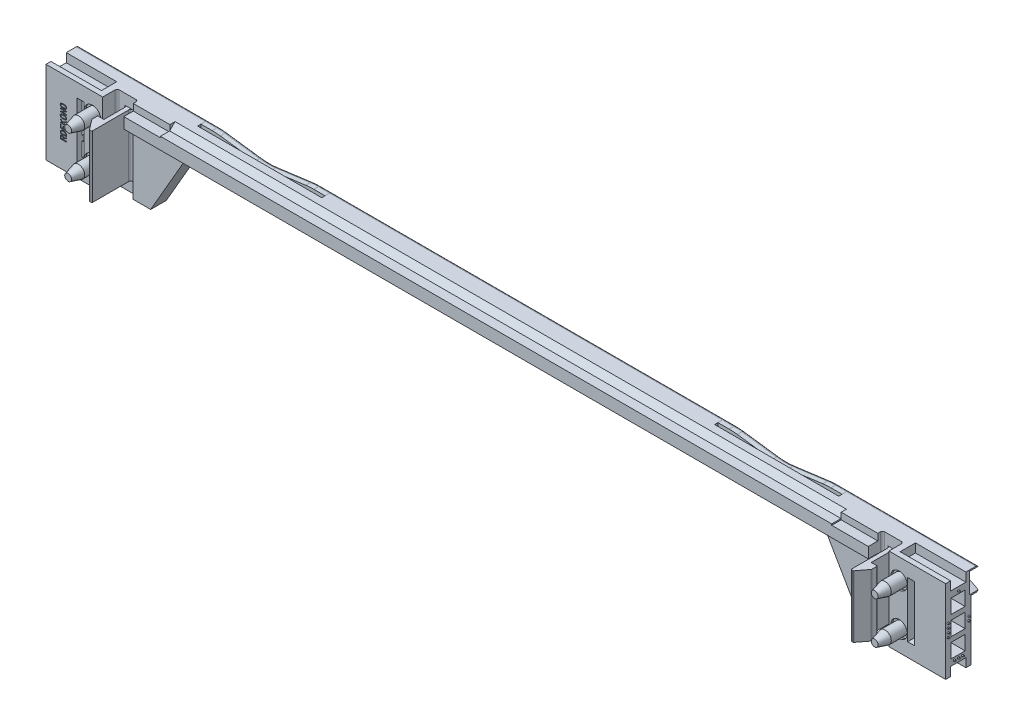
SolidWorks part; units mm, degrees
ref_plane "前视基准面" through (0, 0, 0) normal (0, 0, 1) x (1, 0, 0)
ref_plane "上视基准面" through (0, 0, 0) normal (0, 1, 0) x (1, 0, 0)
ref_plane "右视基准面" through (0, 0, 0) normal (1, 0, 0) x (0, 0, -1)
sketch "草图1" plane through (0, 0, 0) normal (0, 0, 1) x (1, 0, 0)
  line L0 (-77.35, 4.525) -> (77.35, 4.525)
  line L1 (-108.75, 10.025) -> (108.75, 10.025)
  line L2 (-108.75, 10.025) -> (-108.75, -10.025)
  line L3 (-108.75, -10.025) -> (-85.75, -10.025)
  line L4 (108.75, 10.025) -> (108.75, -10.025)
  line L5 (-108.75, 10.025) -> (108.75, -10.025) construction
  line L6 (-108.75, -10.025) -> (108.75, 10.025) construction
  line L7 (-77.35, 4.525) -> (-85.75, -10.025)
  line L8 (77.35, 4.525) -> (85.75, -10.025)
  line L9 (85.75, -10.025) -> (108.75, -10.025)
  point P0 (0, 0)
  point P8 (0, 4.525)
  dimension "D1" = 217.5
  dimension "D2" = 20.05
  dimension "D3" = 5.5
  dimension "D4" = 23
  dimension "D5" = 31.4
extrude "凸台-拉伸1" add sketch "草图1" along normal mid plane 6.1
sketch "草图2" plane through (0, -10.025, 0) normal (0, -1, 0) x (1, 0, 0)
  line L0 (-77.35, 3.05) -> (77.35, 3.05) construction
  line L1 (-95.05, 3.05) -> (95.05, 3.05)
  line L2 (-108.75, -3.05) -> (-85.75, -3.05) construction
  line L3 (-90, 0.75) -> (90, 0.75)
  line L5 (90, 0.75) -> (90, 0.05)
  line L6 (90.5, -0.45) -> (94.55, -0.45)
  line L7 (95.05, 0.05) -> (95.05, 3.05)
  line L8 (85.75, 3.05) -> (108.75, 3.05) construction
  line L9 (-90, 0.75) -> (-90, 0.05)
  line L10 (-90.5, -0.45) -> (-94.55, -0.45)
  line L11 (-95.05, 0.05) -> (-95.05, 3.05)
  line L12 (-108.75, 3.05) -> (-85.75, 3.05) construction
  line L13 (108.75, 3.05) -> (108.75, -3.05) construction
  line L15 (-77.35, -3.05) -> (77.35, -3.05) construction
  arc A0 (-90, 0.05) -> (-90.5, -0.45) centre (-90.5, 0.05) cw
  arc A1 (-94.55, -0.45) -> (-95.05, 0.05) centre (-94.55, 0.05) cw
  arc A2 (94.55, -0.45) -> (95.05, 0.05) centre (94.55, 0.05) ccw
  arc A3 (90, 0.05) -> (90.5, -0.45) centre (90.5, 0.05) ccw
  point P6 (0, 0.75)
  point P22 (-90, -0.45)
  point P25 (-95.05, -0.45)
  dimension "D7" = 0.5
  dimension "D8" = 0.5
  dimension "D1" = 3.8
  dimension "D2" = 13.7
  dimension "D3" = 180
  dimension "D6" = 2.6
extrude "切除-拉伸1" cut sketch "草图2" against normal through all
ref_plane "基准面1" through (0, -7.525, 0) normal (0, -1, 0) x (-1, 0, 0)
sketch "草图3" plane through (0, -7.525, 0) normal (0, -1, 0) x (-1, 0, 0)
  line L0 (91.75, 0.45) -> (92.75, 0.45)
  line L1 (94.55, 0.45) -> (90.5, 0.45) construction
  line L2 (92.75, 0.45) -> (92.75, -5.05)
  line L3 (92.75, -5.05) -> (94.25, -5.05)
  line L4 (94.25, -5.05) -> (94.25, -6.45)
  line L5 (94.25, -6.45) -> (92.35, -8.95)
  line L6 (92.35, -8.95) -> (91.75, -8.95)
  line L7 (91.75, -8.95) -> (91.75, 0.45)
  line L8 (95.05, -3.05) -> (108.75, -3.05) construction
  line L9 (108.75, 3.05) -> (85.75, 3.05) construction
  line L10 (0, 0) -> (0, -11.725) construction
  line L11 (-91.75, -8.95) -> (-91.75, 0.45)
  line L12 (-92.35, -8.95) -> (-91.75, -8.95)
  line L13 (-94.25, -6.45) -> (-92.35, -8.95)
  line L14 (-94.25, -5.05) -> (-94.25, -6.45)
  line L15 (-92.75, -5.05) -> (-94.25, -5.05)
  line L16 (-92.75, 0.45) -> (-92.75, -5.05)
  line L17 (-91.75, 0.45) -> (-92.75, 0.45)
  line L18 (108.75, -3.05) -> (108.75, 3.05) construction
  dimension "D1" = 1
  dimension "D2" = 14.5
  dimension "D3" = 12
  dimension "D4" = 2
  dimension "D5" = 2.5
  dimension "D6" = 9.5
  dimension "D7" = 0.6
extrude "凸台-拉伸2" add sketch "草图3" against normal blind 15
sketch "草图4" plane through (0, 0, 0.75) normal (0, 0, 1) x (1, 0, 0)
  line L0 (-90, 10.025) -> (90, 10.025) construction
  line L1 (-90, 8.725) -> (90, 8.725)
  line L2 (-90, 8.725) -> (-90, 5.825)
  line L3 (-90, 5.825) -> (90, 5.825)
  line L4 (90, 8.725) -> (90, 5.825)
  line L5 (-90, 8.725) -> (90, 5.825) construction
  line L6 (-90, 5.825) -> (90, 8.725) construction
  line L8 (-90, 10.025) -> (-90, -10.025) construction
  point P0 (0, 7.275)
  dimension "D1" = 2.9
  dimension "D2" = 1.3
extrude "凸台-拉伸3" add sketch "草图4" along normal blind 2.25
chamfer "倒角6" distance 1.3 angle 45 1 edges at (0, 4.525, 0.75)
sketch "草图17" plane through (0, 0, 3) normal (0, 0, 1) x (1, 0, 0)
  line L0 (90, 10.025) -> (90, -10.025) construction
  line L1 (90, 8.425) -> (81.15, 8.425)
  line L2 (90, 8.425) -> (90, 10.025)
  line L3 (90, 10.025) -> (81.15, 10.025)
  line L4 (81.15, 8.425) -> (81.15, 10.025)
  line L5 (-90, 10.025) -> (90, 10.025) construction
  line L6 (0, 8.725) -> (0, 15.7989) construction
  line L7 (90, 8.725) -> (-90, 8.725) construction
  line L8 (-81.15, 8.425) -> (-81.15, 10.025)
  line L9 (-90, 10.025) -> (-81.15, 10.025)
  line L10 (-90, 8.425) -> (-90, 10.025)
  line L11 (-90, 8.425) -> (-81.15, 8.425)
  dimension "D1" = 162.3
  dimension "D2" = 1.6
extrude "切除-拉伸10" cut sketch "草图17" against normal blind 2.3
sketch "草图18" plane through (81.15, 0, 0) normal (1, 0, 0) x (0, 0, -1)
  line L0 (-0.75, 10.025) -> (-0.75, 8.725)
  line L1 (-0.75, 8.725) -> (0.55, 10.025)
  line L2 (0.55, 10.025) -> (-0.75, 10.025)
extrude "切除-拉伸11" cut sketch "草图18" against normal up to surface (162.3 mm away)
sketch "草图10" plane through (0, 0, 3.05) normal (0, 0, 1) x (1, 0, 0)
  line L1 (108.75, -10.025) -> (108.75, 10.025) construction
  line L2 (0, 0) -> (0, -13.4841) construction
  circle A0 centre (97.5, 5.08) radius 1.5
  circle A1 centre (97.5, -5.08) radius 1.5
  circle A2 centre (-97.5, -5.08) radius 1.5
  circle A3 centre (-97.5, 5.08) radius 1.5
  point P4 (108.75, 0)
  dimension "D1" = 10.16
  dimension "D2" = 5.08
  dimension "D3" = 3
  dimension "D4" = 195
extrude "凸台-拉伸4" add sketch "草图10" along normal blind 5.9
sketch "草图19" plane through (0, 0, 3.05) normal (0, 0, 1) x (1, 0, 0)
  circle A0 centre (97.5, 5.08) radius 2
  circle A1 centre (97.5, -5.08) radius 2
  circle A2 centre (-97.5, 5.08) radius 2
  circle A3 centre (-97.5, -5.08) radius 2
  circle A4 centre (-97.5, -5.08) radius 1.5
  circle A5 centre (-97.5, 5.08) radius 1.5
  circle A6 centre (97.5, 5.08) radius 1.5
  circle A7 centre (97.5, -5.08) radius 1.5
  dimension "D1" = 3
  dimension "D2" = 4
extrude "切除-拉伸12" cut sketch "草图19" against normal blind 0.5
chamfer "倒角7" distance 2.5 angle 15 4 edges at (-99, 5.08, 8.95) (99, 5.08, 8.95) (99, -5.08, 8.95) (-99, -5.08, 8.95)
sketch "草图12" plane through (-108.75, 0, 0) normal (-1, 0, 0) x (0, 0, 1)
  line L0 (3.05, 10.025) -> (-3.05, 10.025) construction
  line L1 (-1.85, 10.025) -> (1.85, 10.025)
  line L2 (-1.85, 10.025) -> (-1.85, 7.9)
  line L3 (-1.85, 7.9) -> (1.85, 7.9)
  line L4 (1.85, 10.025) -> (1.85, 7.9)
  line L5 (3.05, -10.025) -> (-3.05, -10.025) construction
  line L6 (-1.85, -10.025) -> (1.85, -10.025)
  line L7 (-1.85, -10.025) -> (-1.85, -7.9)
  line L8 (-1.85, -7.9) -> (1.85, -7.9)
  line L9 (1.85, -10.025) -> (1.85, -7.9)
  line L10 (-3.05, 10.025) -> (-3.05, -10.025) construction
  line L11 (3.05, 10.025) -> (3.05, -10.025) construction
  dimension "D1" = 15.8
  dimension "D2" = 1.2
  dimension "D5" = 1.2
extrude "切除-拉伸7" cut sketch "草图12" against normal blind 12.2
sketch "草图13" plane through (-108.75, 0, 0) normal (-1, 0, 0) x (0, 0, 1)
  line L0 (-1.85, 10.025) -> (-1.85, 7.9) construction
  line L1 (-1.85, 6.375) -> (1.6, 6.375)
  line L2 (-1.85, 6.375) -> (-1.85, 2.925)
  line L3 (-1.85, 2.925) -> (1.6, 2.925)
  line L4 (1.6, 6.375) -> (1.6, 2.925)
  line L5 (-1.85, 6.375) -> (1.6, 2.925) construction
  line L6 (-1.85, 2.925) -> (1.6, 6.375) construction
  line L8 (-1.85, 1.725) -> (-1.85, -1.725)
  line L9 (-1.85, 1.725) -> (1.6, 1.725)
  line L10 (-1.85, -1.725) -> (1.6, -1.725)
  line L11 (1.6, 1.725) -> (1.6, -1.725)
  line L12 (-1.85, -2.925) -> (-1.85, -6.375)
  line L13 (-1.85, -2.925) -> (1.6, -2.925)
  line L14 (-1.85, -6.375) -> (1.6, -6.375)
  line L15 (1.6, -2.925) -> (1.6, -6.375)
  point P0 (-0.125, 4.65)
  point P7 (1.6, 0)
  dimension "D1" = 3.45
  dimension "D2" = 3.45
  dimension "D4" = 4.65
  dimension "D3" = 3
extrude "切除-拉伸8" cut sketch "草图13" against normal blind 7.8
sketch "草图30" plane through (0, 0, -3.05) normal (0, 0, -1) x (-1, 0, 0)
  line L0 (-108.75, -10.025) -> (-108.75, 10.025) construction
  line L1 (108.75, 10.025) -> (-108.75, 10.025)
  line L2 (108.75, 10.025) -> (108.75, 4.525)
  line L3 (108.75, 4.525) -> (-108.75, 4.525)
  line L4 (-108.75, 10.025) -> (-108.75, 4.525)
  line L5 (77.35, 4.525) -> (-77.35, 4.525) construction
extrude "切除-拉伸16" cut sketch "草图30" against normal blind 0.3
sketch "草图14" plane through (0, 0, -2.75) normal (0, 0, -1) x (-1, 0, 0)
  line L0 (108.75, 4.525) -> (108.75, -10.025) construction
  line L1 (-108.75, 10.025) -> (108.75, 10.025)
  line L2 (-108.75, 10.025) -> (-108.75, 8.725)
  line L3 (-108.75, 8.725) -> (108.75, 8.725)
  line L4 (108.75, 10.025) -> (108.75, 8.725)
  line L5 (-108.75, -10.025) -> (-108.75, 4.525) construction
  line L6 (-108.75, 5.825) -> (108.75, 5.825)
  line L7 (-108.75, 5.825) -> (-108.75, 4.525)
  line L8 (-108.75, 4.525) -> (108.75, 4.525)
  line L9 (108.75, 5.825) -> (108.75, 4.525)
  line L10 (77.35, 4.525) -> (-77.35, 4.525) construction
  line L11 (108.75, 10.025) -> (-108.75, 10.025) construction
  dimension "D1" = 1.3
  dimension "D2" = 1.3
extrude "凸台-拉伸5" add sketch "草图14" along normal blind 2.1
fillet "圆角1" radius 0.6 2 edges at (0, 4.525, -4.85) (0, 10.025, -4.85)
sketch "草图15" plane through (0, 0, -4.85) normal (0, 0, -1) x (-1, 0, 0)
  line L0 (-108.75, 10.025) -> (108.75, 10.025) construction
  line L1 (-77.5, 10.025) -> (-47.5, 10.025)
  line L2 (-77.5, 10.025) -> (-77.5, 8.725)
  line L3 (-77.5, 8.725) -> (-47.5, 8.725)
  line L4 (-47.5, 10.025) -> (-47.5, 8.725)
  line L5 (-77.5, 10.025) -> (-47.5, 8.725) construction
  line L6 (-77.5, 8.725) -> (-47.5, 10.025) construction
  line L7 (-108.75, 8.725) -> (108.75, 8.725) construction
  line L9 (47.5, 8.725) -> (77.5, 8.725)
  line L10 (47.5, 8.725) -> (47.5, 10.025)
  line L11 (47.5, 10.025) -> (77.5, 10.025)
  line L12 (77.5, 8.725) -> (77.5, 10.025)
  line L13 (47.5, 8.725) -> (77.5, 10.025) construction
  line L14 (47.5, 10.025) -> (77.5, 8.725) construction
  point P0 (-62.5, 9.375)
  point P10 (62.5, 9.375)
  dimension "D1" = 30
  dimension "D2" = 47.5
  dimension "D3" = 47.5
extrude "切除-拉伸9" cut sketch "草图15" against normal blind 2.5
sketch "草图16" plane through (0, 0, -4.85) normal (0, 0, -1) x (-1, 0, 0)
  line L0 (-74.7912, 10.025) -> (-77.5, 10.025)
  line L1 (-47.5, 10.025) -> (-77.5, 10.025) construction
  line L2 (-77.5, 10.025) -> (-77.5, 8.725)
  line L3 (-77.5, 8.725) -> (-74.9741, 8.725)
  line L4 (-77.5, 8.725) -> (-47.5, 8.725) construction
  line L5 (-50.2088, 10.025) -> (-47.5, 10.025)
  line L6 (-47.5, 10.025) -> (-47.5, 8.725)
  line L7 (-47.5, 8.725) -> (-50.0259, 8.725)
  line L8 (-52.1826, 9.8946) -> (-60.5262, 8.787)
  line L9 (-64.4738, 8.787) -> (-72.8174, 9.8946)
  line L11 (108.75, 4.525) -> (-108.75, 4.525) construction
  line L12 (-73.034, 8.599) -> (-64.4401, 7.4781)
  line L13 (-60.5599, 7.4781) -> (-51.966, 8.599)
  line L14 (0, 0) -> (0, -16.4806) construction
  line L15 (60.5599, 7.4781) -> (51.966, 8.599)
  line L16 (73.034, 8.599) -> (64.4401, 7.4781)
  line L17 (64.4738, 8.787) -> (72.8174, 9.8946)
  line L18 (52.1826, 9.8946) -> (60.5262, 8.787)
  line L19 (47.5, 8.725) -> (50.0259, 8.725)
  line L20 (47.5, 10.025) -> (47.5, 8.725)
  line L21 (50.2088, 10.025) -> (47.5, 10.025)
  line L22 (77.5, 8.725) -> (74.9741, 8.725)
  line L23 (77.5, 10.025) -> (77.5, 8.725)
  line L24 (74.7912, 10.025) -> (77.5, 10.025)
  arc A0 (-50.0259, 8.725) -> (-51.966, 8.599) centre (-50.0259, -6.275) ccw
  arc A1 (-50.2088, 10.025) -> (-52.1826, 9.8946) centre (-50.2088, -4.975) ccw
  arc A2 (-60.5599, 7.4781) -> (-64.4401, 7.4781) centre (-62.5, 22.3521) cw
  arc A3 (-60.5262, 8.787) -> (-64.4738, 8.787) centre (-62.5, 23.6566) cw
  arc A4 (-73.034, 8.599) -> (-74.9741, 8.725) centre (-74.9741, -6.275) ccw
  arc A5 (-72.8174, 9.8946) -> (-74.7912, 10.025) centre (-74.7912, -4.975) ccw
  arc A6 (72.8174, 9.8946) -> (74.7912, 10.025) centre (74.7912, -4.975) cw
  arc A7 (73.034, 8.599) -> (74.9741, 8.725) centre (74.9741, -6.275) cw
  arc A8 (60.5262, 8.787) -> (64.4738, 8.787) centre (62.5, 23.6566) ccw
  arc A9 (60.5599, 7.4781) -> (64.4401, 7.4781) centre (62.5, 22.3521) ccw
  arc A10 (50.2088, 10.025) -> (52.1826, 9.8946) centre (50.2088, -4.975) cw
  arc A11 (50.0259, 8.725) -> (51.966, 8.599) centre (50.0259, -6.275) cw
  point P22 (-51, 8.725)
  point P25 (-51.2, 10.025)
  point P28 (-62.5, 7.225)
  point P31 (-62.5, 8.525)
  point P34 (-74, 8.725)
  point P37 (-73.8, 10.025)
  point P63 (73.8, 10.025)
  point P64 (74, 8.725)
  point P65 (62.5, 8.525)
  point P66 (62.5, 7.225)
  point P67 (51.2, 10.025)
  point P68 (51, 8.725)
  dimension "D5" = 15
  dimension "D1" = 3.7
  dimension "D2" = 3.5
  dimension "D3" = 4
  dimension "D4" = 1.3
extrude "凸台-拉伸10" add sketch "草图16" against normal blind 1.7 separate body
fillet "圆角2" radius 0.6 7 edges at (76.1456, 10.025, -4.85) (73.8022, 9.9924, -4.85) (68.6456, 9.3408, -4.85) (62.5, 8.6566, -4.85) (56.3544, 9.3408, -4.85) (51.1978, 9.9924, -4.85) (48.8544, 10.025, -4.85)
fillet "圆角3" radius 0.6 7 edges at (-48.8544, 10.025, -4.85) (-51.1978, 9.9924, -4.85) (-56.3544, 9.3408, -4.85) (-62.5, 8.6566, -4.85) (-68.6456, 9.3408, -4.85) (-73.8022, 9.9924, -4.85) (-76.1456, 10.025, -4.85)
sketch "草图20" plane through (0, 0, 3.05) normal (0, 0, 1) x (1, 0, 0)
  line L0 (-108.75, -1.725) -> (-108.75, 1.725) construction
  line L1 (-101.25, 6.725) -> (-99.55, 6.725)
  line L2 (-101.25, 6.725) -> (-101.25, -6.725)
  line L3 (-101.25, -6.725) -> (-99.55, -6.725)
  line L4 (-99.55, 6.725) -> (-99.55, -6.725)
  line L5 (-95.05, 10.025) -> (-108.75, 10.025) construction
  line L6 (-108.75, -10.025) -> (-95.05, -10.025) construction
  point P4 (-108.75, 0)
  dimension "D1" = 7.5
  dimension "D2" = 3.3
  dimension "D3" = 3.3
  dimension "D4" = 1.7
extrude "切除-拉伸13" cut sketch "草图20" against normal blind 5.2
sketch "草图21" plane through (-108.75, 0, 0) normal (-1, 0, 0) x (0, 0, 1)
  circle A0 centre (0, 7) radius 0.2
  circle A1 centre (-1, 7) radius 0.2
  circle A2 centre (1, 7) radius 0.2
  circle A3 centre (-2.5, -0.5) radius 0.2
  circle A4 centre (-2.5, 0.5) radius 0.2
  circle A5 centre (0, -7) radius 0.2
  circle A6 centre (2.5, -1.5) radius 0.2
  circle A7 centre (2.5, -0.5) radius 0.2
  circle A8 centre (2.5, 0.5) radius 0.2
  circle A9 centre (2.5, 1.5) radius 0.2
  dimension "D2" = 0.4
  dimension "D3" = 1
  dimension "D4" = 0.5
  dimension "D6" = 1
  dimension "D7" = 2.5
  dimension "D8" = 7
  dimension "D9" = 1
  dimension "D10" = 1
  dimension "D1" = 2.5
  dimension "D5" = 1
  dimension "D11" = 7
extrude "凸台-拉伸11" add sketch "草图21" along normal blind 0.3
mirror "镜向1" about plane through (0, 0, 0) normal (1, 0, 0) of "切除-拉伸8"
mirror "镜向2" about plane through (0, 0, 0) normal (1, 0, 0) of "切除-拉伸7"
mirror "镜向3" about plane through (0, 0, 0) normal (1, 0, 0) of "切除-拉伸13"
sketch "草图22" plane through (108.75, 0, 0) normal (1, 0, 0) x (0, 0, -1)
  circle A0 centre (2.5, 0.5) radius 0.2
  circle A1 centre (2.5, -0.5) radius 0.2
  circle A2 centre (-2.5, 1.5) radius 0.2
  circle A3 centre (-2.5, 0.5) radius 0.2
  circle A4 centre (-2.5, -0.5) radius 0.2
  circle A5 centre (-2.5, -1.5) radius 0.2
  circle A6 centre (0, 7) radius 0.2
  circle A7 centre (1, -7) radius 0.2
  circle A8 centre (0, -7) radius 0.2
  circle A9 centre (-1, -7) radius 0.2
  dimension "D3" = 1
  dimension "D5" = 1
  dimension "D6" = 1
  dimension "D7" = 0.4
  dimension "D8" = 7
  dimension "D9" = 1
  dimension "D10" = 1
  dimension "D11" = 7
  dimension "D1" = 2.5
  dimension "D2" = 2.5
  dimension "D4" = 0.5
extrude "凸台-拉伸12" add sketch "草图22" along normal blind 0.3
fillet "圆角5" radius 0.5 4 edges at (-91.75, -0.025, -0.45) (-92.75, -0.025, -0.45) (92.75, -0.025, -0.45) (91.75, -0.025, -0.45)
sketch "草图23" plane through (0, 0, -3.05) normal (0, 0, -1) x (-1, 0, 0)
  line L0 (104.75, 3.525) -> (104.75, -5.4165) construction
  line L1 (108.75, 4.525) -> (108.75, -10.025) construction
  line L2 (108.75, 4.525) -> (77.35, 4.525) construction
  line L3 (-107.35, 4.025) -> (-107.35, -5.6454) construction
  line L4 (-108.75, -10.025) -> (-108.75, 4.525) construction
  line L5 (-108.75, 10.025) -> (-77.5, 10.025) construction
  text T0 "AB  C" font "黑体" height 2.5
  text T1 "DE  F" font "黑体" height 2.5
  dimension "D1" = 4
  dimension "D2" = 1
  dimension "D3" = 1.4
  dimension "D4" = 6
extrude "凸台-拉伸13" add sketch "草图23" along normal blind 0.2
fillet "圆角6" radius 0.2 8 edges at (94.25, -0.025, 5.05) (94.25, -0.025, 6.45) (92.35, -0.025, 8.95) (91.75, -0.025, 8.95) (-94.25, -0.025, 5.05) (-94.25, -0.025, 6.45) (-91.75, -0.025, 8.95) (-92.35, -0.025, 8.95)
sketch "草图25" plane through (-108.75, 0, 0) normal (-1, 0, 0) x (0, 0, 1)
  line L0 (-1.85, 2.925) -> (1.6, 2.925) construction
  line L1 (1.6, 6.375) -> (1.8, 6.375)
  line L2 (1.6, 6.375) -> (1.6, 2.925)
  line L3 (1.6, 2.925) -> (1.8, 2.925)
  line L4 (1.8, 6.375) -> (1.8, 2.925)
  line L5 (-1.85, -1.725) -> (1.6, -1.725) construction
  line L6 (1.6, 1.725) -> (1.8, 1.725)
  line L7 (1.6, 1.725) -> (1.6, -1.725)
  line L8 (1.6, -1.725) -> (1.8, -1.725)
  line L9 (1.8, 1.725) -> (1.8, -1.725)
  line L10 (-1.85, -6.375) -> (1.6, -6.375) construction
  line L11 (1.6, -2.925) -> (1.8, -2.925)
  line L12 (1.6, -2.925) -> (1.6, -6.375)
  line L13 (1.6, -6.375) -> (1.8, -6.375)
  line L14 (1.8, -2.925) -> (1.8, -6.375)
  dimension "D1" = 0.2
  dimension "D2" = 0.2
  dimension "D3" = 0.2
extrude "切除-拉伸14" cut sketch "草图25" against normal up to surface (9.2 mm away)
sketch "草图26" plane through (-108.75, 0, 0) normal (-1, 0, 0) x (0, 0, 1)
  line L0 (-1.85, 2.925) -> (1.8, 2.925) construction
  line L1 (-1.85, 6.375) -> (-1.65, 6.375)
  line L2 (-1.85, 6.375) -> (-1.85, 2.925)
  line L3 (-1.85, 2.925) -> (-1.65, 2.925)
  line L4 (-1.65, 6.375) -> (-1.65, 2.925)
  line L5 (-1.85, -1.725) -> (1.8, -1.725) construction
  line L6 (-1.85, 1.725) -> (-1.65, 1.725)
  line L7 (-1.85, 1.725) -> (-1.85, -1.725)
  line L8 (-1.85, -1.725) -> (-1.65, -1.725)
  line L9 (-1.65, 1.725) -> (-1.65, -1.725)
  line L10 (-1.85, -6.375) -> (1.8, -6.375) construction
  line L11 (-1.85, -2.925) -> (-1.65, -2.925)
  line L12 (-1.85, -2.925) -> (-1.85, -6.375)
  line L13 (-1.85, -6.375) -> (-1.65, -6.375)
  line L14 (-1.65, -2.925) -> (-1.65, -6.375)
  dimension "D1" = 0.2
  dimension "D2" = 0.2
  dimension "D3" = 0.2
extrude "凸台-拉伸15" add sketch "草图26" against normal up to surface (7.5 mm away)
sketch "草图27" plane through (108.75, 0, 0) normal (1, 0, 0) x (0, 0, -1)
  line L1 (1.85, 2.925) -> (-1.6, 2.925) construction
  line L2 (-1.6, 6.375) -> (-1.8, 6.375)
  line L3 (-1.6, 6.375) -> (-1.6, 2.925)
  line L4 (-1.6, 2.925) -> (-1.8, 2.925)
  line L5 (-1.8, 6.375) -> (-1.8, 2.925)
  line L6 (-1.6, 1.725) -> (-1.8, 1.725)
  line L7 (-1.6, 1.725) -> (-1.6, -1.725)
  line L8 (-1.6, -1.725) -> (-1.8, -1.725)
  line L10 (-1.8, 1.725) -> (-1.8, -1.725)
  line L11 (-1.6, -2.925) -> (-1.8, -2.925)
  line L12 (-1.6, -2.925) -> (-1.6, -6.375)
  line L13 (-1.6, -6.375) -> (-1.8, -6.375)
  line L15 (-1.8, -2.925) -> (-1.8, -6.375)
  line L16 (1.85, -1.725) -> (-1.6, -1.725) construction
  line L17 (1.85, -6.375) -> (-1.6, -6.375) construction
  dimension "D1" = 0.2
  dimension "D2" = 0.2
  dimension "D3" = 0.2
extrude "切除-拉伸15" cut sketch "草图27" against normal up to surface (7.5 mm away)
sketch "草图28" plane through (108.75, 0, 0) normal (1, 0, 0) x (0, 0, -1)
  line L0 (1.85, 2.925) -> (-1.8, 2.925) construction
  line L1 (1.85, 6.375) -> (1.65, 6.375)
  line L2 (1.85, 6.375) -> (1.85, 2.925)
  line L3 (1.85, 2.925) -> (1.65, 2.925)
  line L4 (1.65, 6.375) -> (1.65, 2.925)
  line L5 (1.85, -1.725) -> (-1.8, -1.725) construction
  line L6 (1.85, 1.725) -> (1.65, 1.725)
  line L7 (1.85, 1.725) -> (1.85, -1.725)
  line L8 (1.85, -1.725) -> (1.65, -1.725)
  line L9 (1.65, 1.725) -> (1.65, -1.725)
  line L10 (1.85, -6.375) -> (-1.8, -6.375) construction
  line L11 (1.85, -2.925) -> (1.65, -2.925)
  line L12 (1.85, -2.925) -> (1.85, -6.375)
  line L13 (1.85, -6.375) -> (1.65, -6.375)
  line L14 (1.65, -2.925) -> (1.65, -6.375)
  dimension "D1" = 0.2
  dimension "D2" = 0.2
  dimension "D3" = 0.2
extrude "凸台-拉伸16" add sketch "草图28" against normal up to surface (7.5 mm away)
chamfer "倒角9" distance 1 distance2 2 4 edges at (-108.75, 5.825, -3.8) (-108.75, 8.725, -3.8) (108.75, 5.825, -3.8) (108.75, 8.725, -3.8)
sketch "草图31" plane through (0, 0, 3.05) normal (0, 0, 1) x (1, 0, 0)
  line L0 (-103.75, 10.025) -> (-103.75, -10.025) construction
  line L1 (-95.05, 10.025) -> (-108.75, 10.025) construction
  line L2 (-108.75, -10.025) -> (-95.05, -10.025) construction
  line L3 (-108.75, 10.025) -> (-108.75, -10.025) construction
  text T0 "RDEKONO" font "黑体" height 1.5
  dimension "D1" = 5
extrude "切除-拉伸17" cut sketch "草图31" against normal blind 0.3
equation "\"`5\"=0.5"
equation "\"`5.08\"=5.03"
